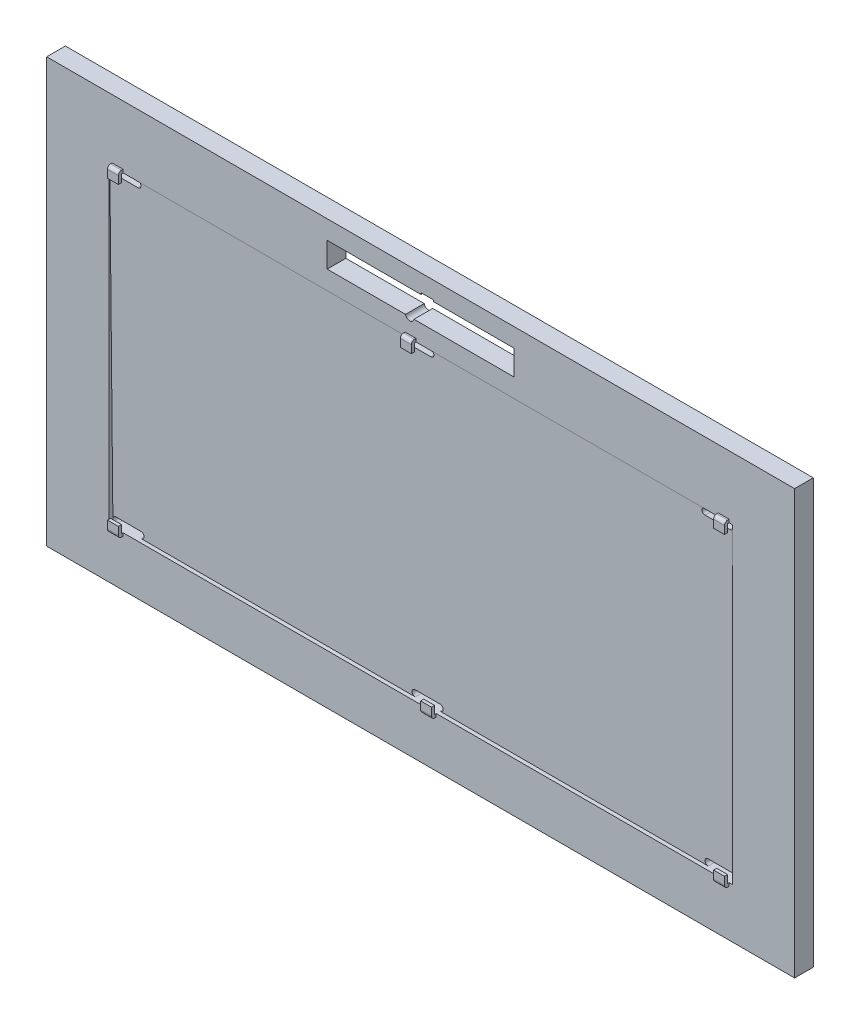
SolidWorks part; units mm, degrees
ref_plane "Plan de face" through (0, 0, 0) normal (0, 0, 1) x (1, 0, 0)
ref_plane "Plan de dessus" through (0, 0, 0) normal (0, 1, 0) x (1, 0, 0)
ref_plane "Plan de droite" through (0, 0, 0) normal (1, 0, 0) x (0, 0, -1)
sketch "Esquisse1" plane through (0, 0, 0) normal (0, 0, 1) x (1, 0, 0)
  line L1 (-120, 68) -> (120, 68)
  line L2 (-120, 68) -> (-120, -68)
  line L3 (-120, -68) -> (120, -68)
  line L4 (120, 68) -> (120, -68)
  dimension "D1" = 240
  dimension "D2" = 120
  dimension "D3" = 136
  dimension "D4" = 68
extrude "Extrusion1" add sketch "Esquisse1" along normal mid plane 6
sketch "Esquisse2" plane through (0, 0, 3) normal (0, 0, 1) x (1, 0, 0)
  line L0 (120, 68) -> (-120, 68) construction
  line L1 (-30, 62) -> (30, 62)
  line L2 (-30, 62) -> (-30, 54)
  line L3 (-30, 54) -> (30, 54)
  line L4 (30, 62) -> (30, 54)
  dimension "D1" = 6
  dimension "D2" = 8
  dimension "D3" = 60
  dimension "D4" = 30
extrude "Enlèv. mat.-Extru.1" cut sketch "Esquisse2" against normal through all
sketch "Esquisse3" plane through (0, 0, 3) normal (0, 0, 1) x (1, 0, 0)
  line L0 (-30, 62) -> (-30, 54) construction
  line L1 (0.1, 62.5) -> (4.2, 62.5)
  line L2 (0.1, 62.5) -> (0.1, 59.7874)
  line L3 (0.1, 59.7874) -> (4.2, 59.7874)
  line L4 (4.2, 62.5) -> (4.2, 59.7874)
  line L6 (30, 62) -> (-30, 62) construction
  dimension "D1" = 30.1
  dimension "D2" = 4.1
  dimension "D3" = 0.5
  dimension "D4" = 2.7126
extrude "Enlèv. mat.-Extru.2" cut sketch "Esquisse3" against normal blind 4
sketch "Esquisse4" plane through (0, 0, 3) normal (0, 0, 1) x (1, 0, 0)
  line L0 (-30, 62) -> (-30, 54) construction
  line L1 (-30, 62) -> (-30, 54) construction
  line L2 (-30, 54) -> (30, 54) construction
  circle A0 centre (-3.5, 54.25) radius 1.375
  point P5 (-30, 58)
  dimension "D3" = 2.75
  dimension "D1" = 26.5
  dimension "D2" = 0.25
extrude "Enlèv. mat.-Extru.3" cut sketch "Esquisse4" against normal through all
sketch "Esquisse6" plane through (0, 0, 0) normal (1, 0, 0) x (0, 0, -1)
  line L0 (3, 48) -> (2.75, 48)
  line L1 (3, 68) -> (3, -68) construction
  line L2 (-2.75, 48) -> (-3, 48)
  line L3 (-3, 68) -> (-3, -68) construction
  line L4 (-3, 68) -> (3, 68) construction
  line L5 (3, -52) -> (1.75, -52)
  line L6 (-1.75, -52) -> (-3, -52)
  line L7 (-3, -68) -> (3, -68) construction
  line L8 (-1.75, -52) -> (-2.75, 48)
  line L9 (2.75, 48) -> (1.75, -52)
  line L10 (3, -52) -> (3, 48)
  line L11 (-3, 48) -> (-3, -52)
  dimension "D1" = 0.25
  dimension "D2" = 0.25
  dimension "D3" = 20
  dimension "D4" = 20
  dimension "D5" = 1.25
  dimension "D6" = 1.25
  dimension "D7" = 16
extrude "Enlèv. mat.-Extru.5" cut sketch "Esquisse6" against normal mid plane 200
sketch "Esquisse7" plane through (0, 0, 0) normal (0, 0, 1) x (1, 0, 0)
  line L0 (99, 48) -> (91, 48)
  line L1 (0, 51.9807) -> (0, -68) construction
  line L2 (-120, -68) -> (120, -68) construction
  line L3 (64.9275, -2) -> (-51.7874, -2) construction
  line L4 (-100, 48) -> (100, 48) construction
  line L5 (99, 46) -> (91, 46)
  line L6 (120, -68) -> (120, 68) construction
  line L7 (-99, 46) -> (-91, 46)
  line L8 (-99, 48) -> (-91, 48)
  line L9 (99, -50) -> (91, -50)
  line L10 (-99, -50) -> (-91, -50)
  line L11 (-99, -52) -> (-91, -52)
  line L12 (91, -52) -> (99, -52)
  line L13 (-100, -52) -> (100, -52) construction
  line L14 (3, 48) -> (-5, 48)
  line L15 (3, 46) -> (-5, 46)
  line L16 (100, -52) -> (100, 48) construction
  line L17 (5, -50) -> (-3, -50)
  line L18 (5, -52) -> (-3, -52)
  arc A0 (99, 46) -> (99, 48) centre (99, 47) ccw
  arc A1 (91, 48) -> (91, 46) centre (91, 47) ccw
  arc A2 (-91, 48) -> (-91, 46) centre (-91, 47) cw
  arc A3 (-99, 46) -> (-99, 48) centre (-99, 47) cw
  arc A4 (91, -52) -> (91, -50) centre (91, -51) cw
  arc A5 (-99, -50) -> (-99, -52) centre (-99, -51) ccw
  arc A6 (-91, -52) -> (-91, -50) centre (-91, -51) ccw
  arc A7 (3, 48) -> (3, 46) centre (3, 47) cw
  arc A8 (-5, 48) -> (-5, 46) centre (-5, 47) ccw
  arc A9 (99, -50) -> (99, -52) centre (99, -51) cw
  arc A10 (-3, -50) -> (-3, -52) centre (-3, -51) ccw
  arc A11 (5, -50) -> (5, -52) centre (5, -51) cw
  dimension "D1" = 50
  dimension "D2" = 8
  dimension "D3" = 2
  dimension "D4" = 2
  dimension "D5" = 21
  dimension "D6" = 8
  dimension "D7" = 2
  dimension "D8" = 2
  dimension "D9" = 97
  dimension "D10" = 8
  dimension "D11" = 2
  dimension "D12" = 2
  dimension "D13" = 115
extrude "Enlèv. mat.-Extru.7" cut sketch "Esquisse7" against normal mid plane 11
sketch "Esquisse8" plane through (0, 0, -3) normal (0, 0, -1) x (-1, 0, 0)
  line L0 (-100, -52) -> (-100, 48) construction
  line L1 (-94.5, 49) -> (-91, 49)
  line L2 (-94.5, 49) -> (-94.5, 45.5)
  line L3 (-94.5, 45.5) -> (-91, 45.5)
  line L4 (-91, 49) -> (-91, 45.5)
  line L5 (100, 48) -> (-100, 48) construction
  line L6 (0, 0) -> (0, 96.2833) construction
  line L7 (91, 49) -> (91, 45.5)
  line L8 (94.5, 45.5) -> (91, 45.5)
  line L9 (94.5, 49) -> (91, 49)
  line L10 (94.5, 49) -> (94.5, 45.5)
  line L11 (-75.8134, -2) -> (56.9957, -2) construction
  line L12 (100, -52) -> (-100, -52) construction
  line L13 (94.5, -53) -> (94.5, -49.5)
  line L14 (94.5, -49.5) -> (91, -49.5)
  line L15 (94.5, -53) -> (91, -53)
  line L16 (91, -53) -> (91, -49.5)
  line L17 (-91, -53) -> (-91, -49.5)
  line L18 (-94.5, -49.5) -> (-91, -49.5)
  line L19 (-94.5, -53) -> (-91, -53)
  line L20 (-94.5, -53) -> (-94.5, -49.5)
  line L22 (-3, 49) -> (0.5, 49)
  line L23 (-3, 49) -> (-3, 45.5)
  line L24 (-3, 45.5) -> (0.5, 45.5)
  line L25 (0.5, 49) -> (0.5, 45.5)
  line L26 (3, -49.5) -> (-0.5, -49.5)
  line L27 (3, -49.5) -> (3, -53)
  line L28 (3, -53) -> (-0.5, -53)
  line L29 (-0.5, -49.5) -> (-0.5, -53)
  arc A0 (-3, 48) -> (-3, 46) centre (-3, 47) ccw construction
  arc A1 (3, -52) -> (3, -50) centre (3, -51) ccw construction
  point P31 (-4, 47)
  point P39 (4, -51)
  dimension "D1" = 5.5
  dimension "D2" = 3.5
  dimension "D3" = 1
  dimension "D4" = 2.5
  dimension "D5" = 50
  dimension "D6" = 3.5
  dimension "D7" = 1
  dimension "D8" = 1
  dimension "D9" = 2.5
  dimension "D10" = 1
  dimension "D11" = 3.5
  dimension "D12" = 1
  dimension "D13" = 2.5
extrude "Extrusion2" add sketch "Esquisse8" along normal blind 1.5
fillet "Congé1" radius 1 6 edges at (92.75, -53, -4.5) (-1.25, -53, -4.5) (-92.75, -53, -4.5) (-92.75, 49, -4.5) (1.25, 49, -4.5) (92.75, 49, -4.5)
sketch "Esquisse9" plane through (-94.5, 0, 0) normal (-1, 0, 0) x (0, 0, 1)
  line L0 (-4.5, 48) -> (-4.5, 45.5) construction
  line L1 (-3.5, 48) -> (-3, 48)
  line L2 (-3.5, 48) -> (-3.5, 45.5)
  line L3 (-3.5, 45.5) -> (-3, 45.5)
  line L4 (-3, 48) -> (-3, 45.5)
  line L5 (-4.5, 45.5) -> (-3, 45.5) construction
  point P4 (-4.5, 46.75)
  dimension "D1" = 0.5
  dimension "D2" = 1
  dimension "D3" = 2.5
  dimension "D4" = 2.5
extrude "Enlèv. mat.-Extru.8" cut sketch "Esquisse9" against normal through all
sketch "Esquisse10" plane through (-94.5, 0, 0) normal (-1, 0, 0) x (0, 0, 1)
  line L0 (-3, 68) -> (-3, -68) construction
  line L1 (-3.5, -49.5) -> (-3, -49.5)
  line L2 (-3.5, -49.5) -> (-3.5, -52)
  line L3 (-3.5, -52) -> (-3, -52)
  line L4 (-3, -49.5) -> (-3, -52)
  line L5 (-4.5, -49.5) -> (-3, -49.5) construction
  dimension "D1" = 0.5
  dimension "D2" = 0.5
  dimension "D3" = 2.5
  dimension "D4" = 2.5
extrude "Enlèv. mat.-Extru.9" cut sketch "Esquisse10" against normal through all
sketch "Esquisse11" plane through (0, 0, 3) normal (0, 0, 1) x (1, 0, 0)
  line L0 (0, 29.9517) -> (0, -80.5797) construction
  line L1 (-79.6135, -2) -> (65.7005, -2) construction
  line L2 (-100, -52) -> (100, -52) construction
  line L3 (-100, 48) -> (-100, -52) construction
  line L4 (-99, 49) -> (-95.5, 49)
  line L5 (-99, 49) -> (-99, 45.5)
  line L6 (-99, 45.5) -> (-95.5, 45.5)
  line L7 (-95.5, 49) -> (-95.5, 45.5)
  line L8 (-100, 48) -> (100, 48) construction
  line L9 (99, 45.5) -> (95.5, 45.5)
  line L10 (95.5, 49) -> (95.5, 45.5)
  line L11 (99, 49) -> (95.5, 49)
  line L12 (99, 49) -> (99, 45.5)
  line L13 (-95.5, -53) -> (-95.5, -49.5)
  line L14 (-99, -49.5) -> (-95.5, -49.5)
  line L15 (-99, -53) -> (-95.5, -53)
  line L16 (-99, -53) -> (-99, -49.5)
  line L17 (99, -53) -> (99, -49.5)
  line L18 (99, -49.5) -> (95.5, -49.5)
  line L19 (99, -53) -> (95.5, -53)
  line L20 (95.5, -53) -> (95.5, -49.5)
  dimension "D1" = 50
  dimension "D2" = 1
  dimension "D3" = 3.5
  dimension "D4" = 1
  dimension "D5" = 2.5
extrude "Extrusion3" add sketch "Esquisse11" along normal blind 1.5
sketch "Esquisse12" plane through (0, 0, 3) normal (0, 0, 1) x (1, 0, 0)
  line L0 (-0.5, 45.5) -> (-0.5, 48) construction
  line L1 (-5, 49) -> (-1.5, 49)
  line L2 (-5, 49) -> (-5, 45.5)
  line L3 (-5, 45.5) -> (-1.5, 45.5)
  line L4 (-1.5, 49) -> (-1.5, 45.5)
  line L5 (-95.5, 48) -> (95.5, 48) construction
  line L6 (-16.0695, -2) -> (16.0302, -2) construction
  line L7 (-95.5, -52) -> (95.5, -52) construction
  dimension "D1" = 3.5
  dimension "D2" = 1
  dimension "D3" = 1
  dimension "D4" = 2.5
  dimension "D5" = 50
extrude "Extrusion4" add sketch "Esquisse12" along normal blind 1.5
sketch "Esquisse13" plane through (0, 0, 3) normal (0, 0, 1) x (1, 0, 0)
  line L0 (0.5, -49.5) -> (0.5, -52) construction
  line L1 (1.5, -49.5) -> (5, -49.5)
  line L2 (1.5, -49.5) -> (1.5, -53)
  line L3 (1.5, -53) -> (5, -53)
  line L4 (5, -49.5) -> (5, -53)
  line L5 (-95.5, -52) -> (95.5, -52) construction
  point P7 (0.5, -50.75)
  dimension "D1" = 1
  dimension "D2" = 3.5
  dimension "D3" = 1
  dimension "D4" = 2.5
extrude "Extrusion5" add sketch "Esquisse13" along normal blind 1.5
fillet "Congé2" radius 1 6 edges at (-97.25, -53, 4.5) (3.25, -53, 4.5) (97.25, -53, 4.5) (97.25, 49, 4.5) (-3.25, 49, 4.5) (-97.25, 49, 4.5)
sketch "Esquisse14" plane through (99, 0, 0) normal (1, 0, 0) x (0, 0, -1)
  line L0 (-4.5, 45.5) -> (-3, 45.5) construction
  line L1 (-3.5, 48) -> (-3, 48)
  line L2 (-3.5, 48) -> (-3.5, 45.5)
  line L3 (-3.5, 45.5) -> (-3, 45.5)
  line L4 (-3, 48) -> (-3, 45.5)
  line L5 (-3, -68) -> (-3, 68) construction
  dimension "D1" = 2.5
  dimension "D2" = 2.5
  dimension "D3" = 0.5
  dimension "D4" = 0.5
extrude "Enlèv. mat.-Extru.10" cut sketch "Esquisse14" against normal through all
sketch "Esquisse15" plane through (99, 0, 0) normal (1, 0, 0) x (0, 0, -1)
  line L0 (-3, -68) -> (-3, 68) construction
  line L1 (-3.5, -49.5) -> (-3, -49.5)
  line L2 (-3.5, -49.5) -> (-3.5, -52)
  line L3 (-3.5, -52) -> (-3, -52)
  line L4 (-3, -49.5) -> (-3, -52)
  line L5 (-4.5, -49.5) -> (-3, -49.5) construction
  dimension "D1" = 0.5
  dimension "D2" = 0.5
  dimension "D3" = 2.5
  dimension "D4" = 2.5
extrude "Enlèv. mat.-Extru.11" cut sketch "Esquisse15" against normal through all
